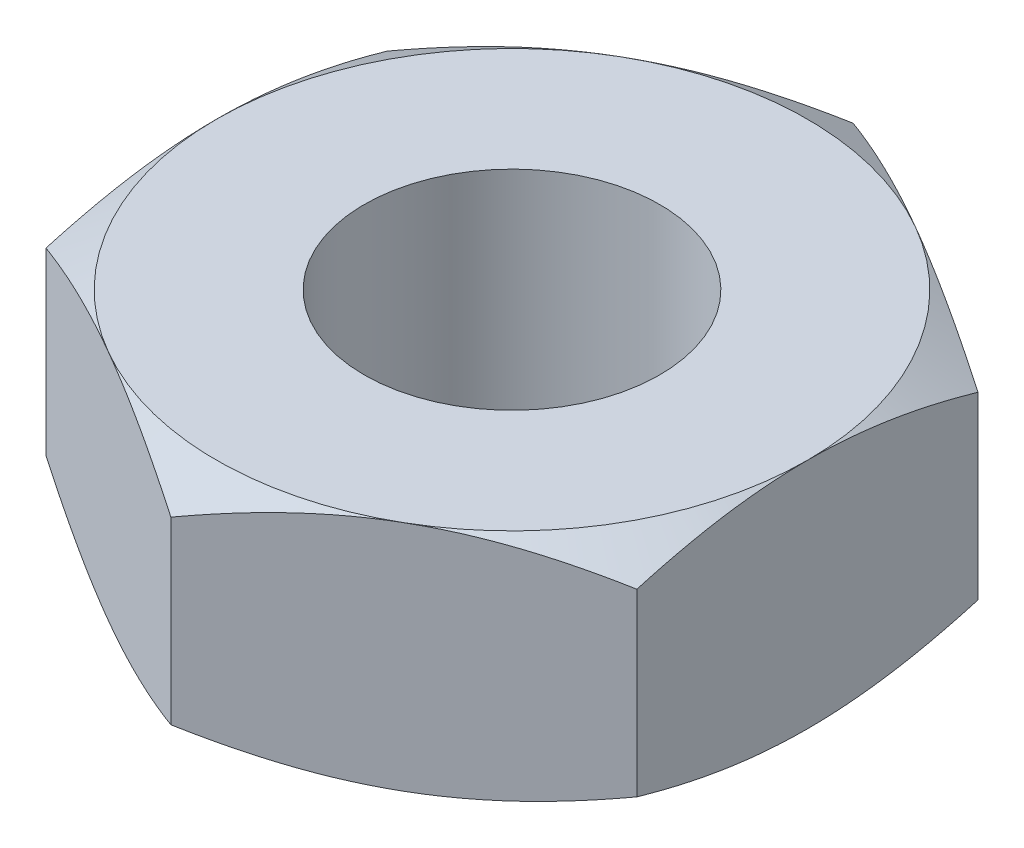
SolidWorks part; units mm, degrees
ref_plane "Front Plane" through (0, 0, 0) normal (0, 0, 1) x (1, 0, 0)
ref_plane "Top Plane" through (0, 0, 0) normal (0, 1, 0) x (1, 0, 0)
ref_plane "Right Plane" through (0, 0, 0) normal (1, 0, 0) x (0, 0, -1)
sketch "Sketch1" plane through (0, 0, 0) normal (0, 1, 0) x (1, 0, 0)
  line L1 (0, 14.6647) -> (-12.7, 7.3323)
  line L2 (-12.7, 7.3323) -> (-12.7, -7.3323)
  line L3 (-12.7, -7.3323) -> (0, -14.6647)
  line L4 (0, -14.6647) -> (12.7, -7.3323)
  line L5 (12.7, -7.3323) -> (12.7, 7.3323)
  line L6 (12.7, 7.3323) -> (0, 14.6647)
  circle A0 centre (0, 0) radius 12.7 construction
  dimension "D1" = 25.4
extrude "Boss-Extrude1" add sketch "Sketch1" along normal mid plane 10
sketch "Sketch2" plane through (0, 5, 0) normal (0, 1, 0) x (1, 0, 0)
  circle A0 centre (0, 0) radius 6.35
  dimension "D1" = 12.7
extrude "Cut-Extrude1" cut sketch "Sketch2" against normal through all
sketch "Sketch3" plane through (0, 5, 0) normal (0, 1, 0) x (1, 0, 0)
  circle A0 centre (0, 0) radius 12.7
extrude "Cut-Extrude2" cut sketch "Sketch3" against normal through all draft 60 flip side to cut
mirror "Mirror1" about plane through (0, 0, 0) normal (0, 1, 0) of "Cut-Extrude2"
